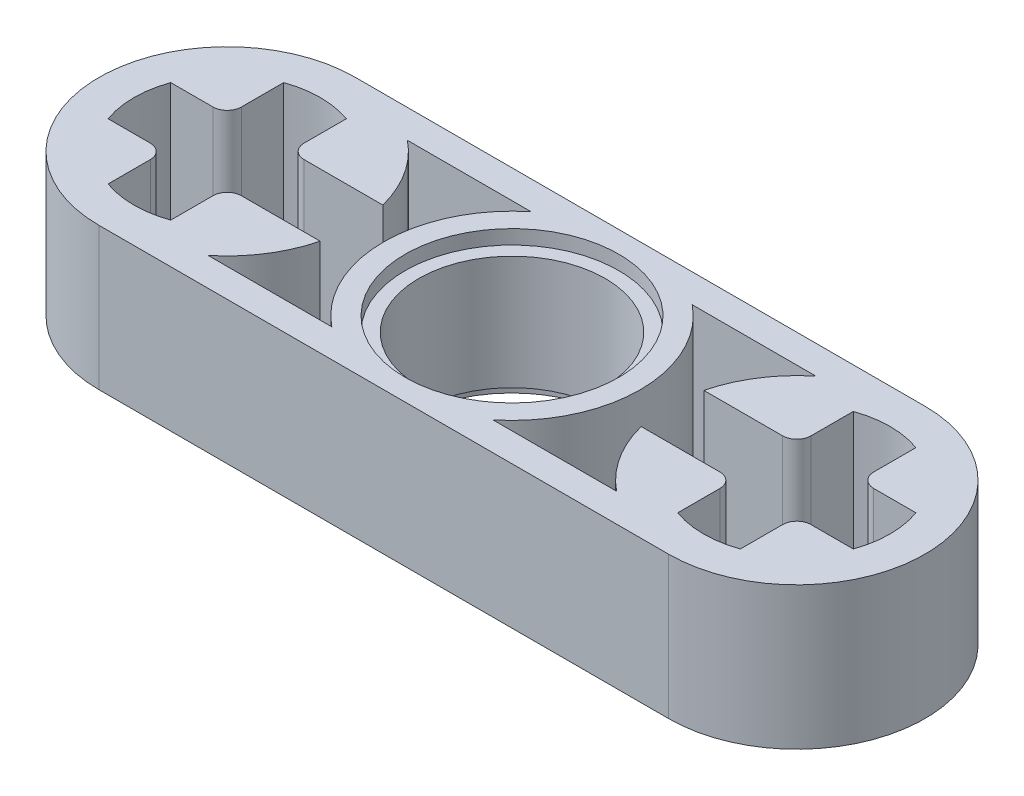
SolidWorks part; units mm, degrees
ref_plane "Front Plane" through (0, 0, 0) normal (0, 0, 1) x (1, 0, 0)
ref_plane "Top Plane" through (0, 0, 0) normal (0, 1, 0) x (1, 0, 0)
ref_plane "Right Plane" through (0, 0, 0) normal (1, 0, 0) x (0, 0, -1)
sketch "Sketch1" plane through (0, 0, 0) normal (0, 1, 0) x (1, 0, 0)
  line L0 (-8, -3.6) -> (8, -3.6)
  line L1 (-8, 3.6) -> (8, 3.6)
  line L2 (-10.4659, 0.88) -> (-9.28, 0.88)
  line L3 (-10.4659, -0.88) -> (-9.28, -0.88)
  line L4 (-8.88, 2.4659) -> (-8.88, 1.28)
  line L5 (-7.12, 2.4659) -> (-7.12, 1.28)
  line L6 (7.12, 2.4659) -> (7.12, 1.28)
  line L7 (8.88, -2.4659) -> (8.88, -1.28)
  line L8 (-6.72, 0.88) -> (-5.5341, 0.88)
  line L9 (-6.72, -0.88) -> (-5.5341, -0.88)
  line L10 (-7.12, -1.28) -> (-7.12, -2.4659)
  line L11 (-8.88, -1.28) -> (-8.88, -2.4659)
  line L12 (5.5341, 0.88) -> (6.72, 0.88)
  line L13 (5.5341, -0.88) -> (6.72, -0.88)
  line L14 (9.28, 0.88) -> (10.4659, 0.88)
  line L15 (7.12, -1.28) -> (7.12, -2.4659)
  line L16 (9.28, -0.88) -> (10.4659, -0.88)
  line L17 (8.88, 1.28) -> (8.88, 2.4659)
  circle A0 centre (0, 0) radius 2.6182
  arc A1 (5.5341, 0.88) -> (5.5341, -0.88) centre (8, 0) ccw
  arc A2 (-5.5341, -0.88) -> (-5.5341, 0.88) centre (-8, 0) ccw
  arc A3 (8, 3.6) -> (8, -3.6) centre (8, 0) cw
  arc A4 (-8, 3.6) -> (-8, -3.6) centre (-8, 0) ccw
  arc A5 (-8.88, -2.4659) -> (-7.12, -2.4659) centre (-8, 0) ccw
  arc A6 (-10.4659, 0.88) -> (-10.4659, -0.88) centre (-8, 0) ccw
  arc A7 (-7.12, 2.4659) -> (-8.88, 2.4659) centre (-8, 0) ccw
  arc A8 (8.88, 2.4659) -> (7.12, 2.4659) centre (8, 0) ccw
  arc A9 (10.4659, -0.88) -> (10.4659, 0.88) centre (8, 0) ccw
  arc A10 (7.12, -2.4659) -> (8.88, -2.4659) centre (8, 0) ccw
  arc A11 (-9.28, 0.88) -> (-8.88, 1.28) centre (-9.28, 1.28) ccw
  arc A12 (-9.28, -0.88) -> (-8.88, -1.28) centre (-9.28, -1.28) cw
  arc A13 (-6.72, -0.88) -> (-7.12, -1.28) centre (-6.72, -1.28) ccw
  arc A14 (-6.72, 0.88) -> (-7.12, 1.28) centre (-6.72, 1.28) cw
  arc A15 (6.72, 0.88) -> (7.12, 1.28) centre (6.72, 1.28) ccw
  arc A16 (7.12, -1.28) -> (6.72, -0.88) centre (6.72, -1.28) ccw
  arc A17 (9.28, -0.88) -> (8.88, -1.28) centre (9.28, -1.28) ccw
  arc A18 (9.28, 0.88) -> (8.88, 1.28) centre (9.28, 1.28) cw
  point P39 (-8.88, -0.88)
  point P42 (-7.12, -0.88)
  point P53 (8.88, 0.88)
  dimension "D1" = 8
  dimension "D7" = 0.4
  dimension "D2" = 8
  dimension "D3" = 3.6
  dimension "D4" = 7.2
  dimension "D5" = 0
  dimension "D6" = 0.88
  dimension "D8" = 0.88
  dimension "D9" = 1.76
  dimension "D10" = 0.88
  dimension "D11" = 1.76
extrude "Boss-Extrude1" add sketch "Sketch1" along normal blind 4
sketch "Sketch2" plane through (0, 4, 0) normal (0, 1, 0) x (1, 0, 0)
  circle A0 centre (0, 0) radius 3
extrude "Cut-Extrude1" cut sketch "Sketch2" against normal blind 0.4
sketch "Sketch3" plane through (0, 0, 0) normal (0, -1, 0) x (1, 0, 0)
  circle A0 centre (0, 0) radius 3
extrude "Cut-Extrude2" cut sketch "Sketch3" against normal blind 0.4
sketch "Sketch4" plane through (0, 0, 0) normal (0, -1, 0) x (1, 0, 0)
  line L0 (-5.7373, 2.8) -> (-2.2627, 2.8)
  line L1 (-5.7373, -2.8) -> (-2.2627, -2.8)
  line L2 (-8, 3.6) -> (8, 3.6) construction
  line L3 (8, -3.6) -> (-8, -3.6) construction
  line L4 (2.2627, -2.8) -> (5.7373, -2.8)
  line L5 (2.2627, 2.8) -> (5.7373, 2.8)
  line L6 (-5.5341, 0.88) -> (-4.5092, 0.88)
  line L7 (-5.5341, -0.88) -> (-4.5092, -0.88)
  line L8 (5.5341, 0.88) -> (4.5092, 0.88)
  line L9 (5.5341, -0.88) -> (4.5092, -0.88)
  line L10 (-5.5341, 0.88) -> (-5.5341, -0.88)
  line L11 (5.5341, 0.88) -> (5.5341, -0.88)
  arc A0 (2.2627, -2.8) -> (2.2627, 2.8) centre (0, 0) ccw
  arc A1 (-5.7373, -2.8) -> (-4.5092, -0.88) centre (-8, 0) ccw
  arc A2 (5.7373, 2.8) -> (4.5092, 0.88) centre (8, 0) ccw
  arc A3 (-2.2627, 2.8) -> (-2.2627, -2.8) centre (0, 0) ccw
  arc A4 (-4.5092, 0.88) -> (-5.7373, 2.8) centre (-8, 0) ccw
  arc A5 (4.5092, -0.88) -> (5.7373, -2.8) centre (8, 0) ccw
  dimension "D1" = 0.8
  dimension "D2" = 0.8
extrude "Cut-Extrude3" cut sketch "Sketch4" against normal up to surface (4 mm away)
